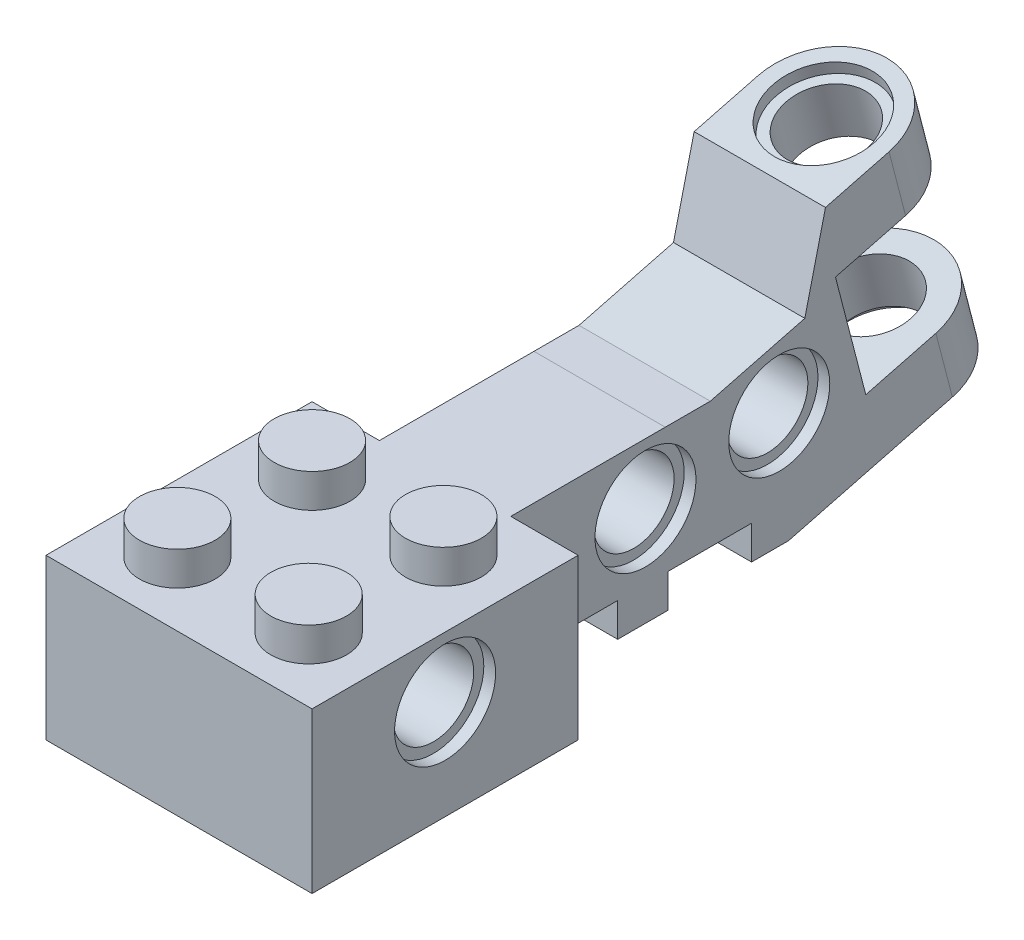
SolidWorks part; units mm, degrees
ref_plane "Front Plane" through (0, 0, 0) normal (0, 0, 1) x (1, 0, 0)
ref_plane "Top Plane" through (0, 0, 0) normal (0, 1, 0) x (1, 0, 0)
ref_plane "Right Plane" through (0, 0, 0) normal (1, 0, 0) x (0, 0, -1)
sketch "Sketch1" plane through (0, 0, 0) normal (0, 1, 0) x (1, 0, 0)
  line L1 (7.9, -7.9) -> (-7.9, -7.9)
  line L2 (7.9, -7.9) -> (7.9, 7.9)
  line L3 (7.9, 7.9) -> (-7.9, 7.9)
  line L4 (-7.9, -7.9) -> (-7.9, 7.9)
  line L5 (7.9, -7.9) -> (-7.9, 7.9) construction
  line L6 (7.9, 7.9) -> (-7.9, -7.9) construction
  point P0 (0, 0)
  dimension "D1" = 15.8
  dimension "D2" = 15.8
extrude "Extrude1" add sketch "Sketch1" along normal blind 9.5
sketch "Sketch2" plane through (0, 9.5, 0) normal (0, 1, 0) x (1, 0, 0)
  line L0 (7.9, 7.9) -> (-7.9, 7.9) construction
  line L3 (7.9, -7.9) -> (7.9, 7.9) construction
  line L4 (-7.9, 7.9) -> (-7.9, -7.9) construction
  circle A0 centre (-3.9, 3.9) radius 2.25
  circle A1 centre (3.9, 3.9) radius 2.25
  point P7 (-6.15, 3.9)
  point P9 (6.15, 3.9)
  dimension "D1" = 4.5
  dimension "D2" = 4.5
  dimension "D3" = 1.75
  dimension "D5" = 4
  dimension "D4" = 1.75
  dimension "D6" = 4
extrude "Extrude7" add sketch "Sketch2" along normal blind 2
sketch "Sketch6" plane through (0, 0, 0) normal (0, -1, 0) x (1, 0, 0)
  line L0 (-7.9, 7.9) -> (7.9, 7.9) construction
  line L1 (6.15, -6.15) -> (-6.15, -6.15)
  line L2 (6.15, -6.15) -> (6.15, 6.15)
  line L3 (6.15, 6.15) -> (-6.15, 6.15)
  line L4 (-6.15, -6.15) -> (-6.15, 6.15)
  line L5 (6.15, -6.15) -> (-6.15, 6.15) construction
  line L6 (6.15, 6.15) -> (-6.15, -6.15) construction
  line L7 (7.9, 7.9) -> (7.9, -7.9) construction
  point P0 (0, 0)
  dimension "D1" = 1.75
  dimension "D2" = 1.75
extrude "Extrude8" cut sketch "Sketch6" against normal blind 1.7
sketch "Sketch8" plane through (0, 9.5, 0) normal (0, 1, 0) x (-1, 0, 0)
  line L0 (-11.776, 0) -> (-11.07, 0) construction
  line L1 (11.6048, 0) -> (-12.4391, 0) construction
  line L2 (0, -8.6314) -> (0, 8.5673) construction
pattern_linear "LPattern4" count 2 spacing 8 along (0, 0, 1) of "Extrude7"
sketch "Sketch10" plane through (0, 1.7, 0) normal (0, -1, 0) x (1, 0, 0)
  line L0 (0, 8.5651) -> (0, -8.6969) construction
sketch "Sketch11" plane through (7.9, 0, 0) normal (1, 0, 0) x (0, 0, -1)
  line L0 (-7.9, 5.9) -> (7.9, 5.9) construction
  line L1 (-7.9, 9.5) -> (-7.9, 0) construction
  line L2 (7.9, 9.5) -> (7.9, 0) construction
  line L3 (-7.9, 9.5) -> (7.9, 9.5) construction
  line L4 (0, 9.5) -> (0, -0.7902) construction
  circle A0 centre (0, 5.9) radius 3
  dimension "D2" = 6
  dimension "D1" = 3.6
extrude "Cut-Extrude1" cut sketch "Sketch11" against normal blind 0.7
sketch "Sketch12" plane through (-7.9, 0, 0) normal (-1, 0, 0) x (0, 0, 1)
  circle A0 centre (0, 5.9) radius 3
  dimension "D1" = 6
extrude "Cut-Extrude2" cut sketch "Sketch12" against normal blind 0.7
sketch "Sketch13" plane through (-7.9, 0, 0) normal (-1, 0, 0) x (0, 0, 1)
  circle A0 centre (0, 5.9) radius 2.4
  dimension "D1" = 4.8
extrude "Cut-Extrude3" cut sketch "Sketch13" against normal through all
sketch "Sketch14" plane through (0, 0, -7.9) normal (0, 0, -1) x (-1, 0, 0)
  line L0 (-7.9, 0) -> (7.9, 0) construction
  line L1 (-3.9, 0) -> (3.9, 0)
  line L2 (-3.9, 0) -> (-3.9, 18)
  line L3 (-3.9, 18) -> (3.9, 18)
  line L4 (3.9, 0) -> (3.9, 18)
  line L5 (0, 9.5) -> (0, 0) construction
  line L6 (-7.9, 9.5) -> (7.9, 9.5) construction
  dimension "D1" = 7.8
  dimension "D2" = 3.9
  dimension "D3" = 18
extrude "Boss-Extrude1" add sketch "Sketch14" along normal blind 30
sketch "Sketch15" plane through (3.9, 0, 0) normal (1, 0, 0) x (0, 0, -1)
  line L0 (24.4, 0) -> (37.9, 3.5)
  line L1 (37.9, 0) -> (7.9, 0) construction
  line L2 (7.9, 9.5) -> (7.9, 0) construction
  line L3 (37.9, 18) -> (37.9, 0) construction
  dimension "D1" = 16.5
  dimension "D2" = 3.5
extrude "Cut-Extrude4" cut sketch "Sketch15" against normal through all and the other way through all flip side to cut
sketch "Sketch16" plane through (3.9, 0, 0) normal (1, 0, 0) x (0, 0, -1)
  line L0 (37.9, 3.5) -> (34.1407, 18)
  line L1 (37.9, 18) -> (7.9, 18) construction
extrude "Cut-Extrude5" cut sketch "Sketch16" against normal through all and the other way through all flip side to cut
sketch "Sketch17" plane through (3.9, 0, 0) normal (1, 0, 0) x (0, 0, -1)
  line L0 (7.9, 9.5) -> (17.0766, 9.5)
  line L1 (17.0766, 9.5) -> (19.7522, 9.5)
  line L2 (19.7522, 9.5) -> (25.3624, 10.9545)
  line L3 (25.3624, 10.9545) -> (26.5904, 16.0425)
  line L4 (26.5904, 16.0425) -> (34.1407, 18)
  line L5 (37.9, 3.5) -> (34.1407, 18) construction
  line L6 (24.4, 0) -> (37.9, 3.5) construction
  dimension "D1" = 90
  dimension "D2" = 7.8
  dimension "D3" = 165.466
  dimension "D4" = 118.103
extrude "Cut-Extrude6" cut sketch "Sketch17" against normal through all and the other way through all
fillet "Fillet1" radius 3.9 2 edges at (-3.9, 10.75, -36.0204) (3.9, 10.75, -36.0204)
sketch "Sketch18" plane through (0, 8.5725, 2.2225) normal (0, 0.968, 0.251) x (1, 0, 0)
  circle A0 centre (0, 33.6654) radius 3
  dimension "D1" = 6
extrude "Cut-Extrude7" cut sketch "Sketch18" against normal blind 0.7
sketch "Sketch19" plane through (0, -5.9275, -1.5368) normal (0, -0.968, -0.251) x (1, 0, 0)
  circle A0 centre (0, -33.6654) radius 3
  dimension "D1" = 6
extrude "Cut-Extrude8" cut sketch "Sketch19" against normal blind 0.7
sketch "Sketch20" plane through (0, -5.2499, -1.3611) normal (0, -0.968, -0.251) x (1, 0, 0)
  circle A0 centre (0, -33.6654) radius 2.4
  dimension "D1" = 4.8
extrude "Cut-Extrude9" cut sketch "Sketch20" against normal through all
sketch "Sketch21" plane through (0, 0, 0) normal (1, 0, 0) x (0, 0, -1)
  line L0 (35.1195, 14.2248) -> (27.1819, 12.1669)
  line L1 (34.1407, 18) -> (37.9, 3.5) construction
  line L2 (27.1819, 12.1669) -> (28.9837, 5.2173)
  line L3 (28.9837, 5.2173) -> (36.9212, 7.2752)
  line L4 (34.1407, 18) -> (30.3656, 17.0212) construction
  line L5 (34.1248, 2.5212) -> (37.9, 3.5) construction
  dimension "D1" = 3.9
  dimension "D2" = 3.9
  dimension "D3" = 8.2
extrude "Cut-Extrude10" cut sketch "Sketch21" against normal through all and the other way through all
sketch "Sketch22" plane through (3.9, 0, 0) normal (1, 0, 0) x (0, 0, -1)
  line L0 (9.3, 0) -> (9.3, 2)
  line L1 (24.4, 0) -> (7.9, 0) construction
  line L2 (9.3, 2) -> (14.25, 2)
  line L3 (14.25, 2) -> (14.25, 0)
  line L7 (7.9, 9.5) -> (7.9, 0) construction
  dimension "D1" = 2
  dimension "D3" = 4.95
  dimension "D5" = 1.4
extrude "Cut-Extrude16" cut sketch "Sketch22" against normal through all and the other way through all flip side to cut
sketch "Sketch23" plane through (3.9, 0, 0) normal (1, 0, 0) x (0, 0, -1)
  line L0 (17.25, 0) -> (17.25, 2)
  line L1 (24.4, 0) -> (14.25, 0) construction
  line L2 (17.25, 2) -> (22.2, 2)
  line L3 (22.2, 2) -> (22.2, 0)
  line L4 (14.25, 2) -> (14.25, 0) construction
  dimension "D1" = 3
  dimension "D2" = 2
  dimension "D3" = 4.95
extrude "Cut-Extrude17" cut sketch "Sketch23" against normal through all and the other way through all flip side to cut
sketch "Sketch24" plane through (3.9, 0, 0) normal (1, 0, 0) x (0, 0, -1)
  line L0 (7.9, 5.9) -> (21.4026, 5.9) construction
  line L1 (7.9, 9.5) -> (7.9, 0) construction
  line L2 (21.4026, 5.9) -> (29.9537, 8.242) construction
  line L3 (7.9, 9.5) -> (17.0766, 9.5) construction
  line L5 (7.9, 9.5) -> (7.9, 0) construction
  circle A0 centre (15.9, 5.9) radius 3
  dimension "D2" = 6
  dimension "D1" = 3.6
  dimension "D3" = 8
extrude "Cut-Extrude18" cut sketch "Sketch24" against normal blind 0.7
sketch "Sketch25" plane through (-3.9, 0, 0) normal (-1, 0, 0) x (0, 0, 1)
  circle A0 centre (-15.9, 5.9) radius 3
  dimension "D1" = 6
extrude "Cut-Extrude19" cut sketch "Sketch25" against normal blind 0.7
sketch "Sketch26" plane through (-3.9, 0, 0) normal (-1, 0, 0) x (0, 0, 1)
  circle A0 centre (-15.9, 5.9) radius 2.4
  dimension "D1" = 4.8
extrude "Cut-Extrude20" cut sketch "Sketch26" against normal through all
sketch "Sketch27" plane through (3.9, 0, 0) normal (1, 0, 0) x (0, 0, -1)
  line L0 (20.1665, 5.8884) -> (28.8439, 8.1381) construction
  line L1 (19.7522, 9.5) -> (25.3624, 10.9545) construction
  circle A0 centre (23.8444, 6.8419) radius 3
  circle A1 centre (15.9, 5.9) radius 2.4 construction
  dimension "D2" = 6
  dimension "D3" = 8
  dimension "D1" = 3.6
extrude "Cut-Extrude21" cut sketch "Sketch27" against normal blind 0.7
sketch "Sketch28" plane through (-3.9, 0, 0) normal (-1, 0, 0) x (0, 0, 1)
  circle A0 centre (-23.8444, 6.8419) radius 3
  dimension "D1" = 6
extrude "Cut-Extrude22" cut sketch "Sketch28" against normal blind 0.7
sketch "Sketch29" plane through (-3.9, 0, 0) normal (-1, 0, 0) x (0, 0, 1)
  circle A0 centre (-23.8444, 6.8419) radius 2.4
  dimension "D1" = 4.8
extrude "Cut-Extrude23" cut sketch "Sketch29" against normal through all
